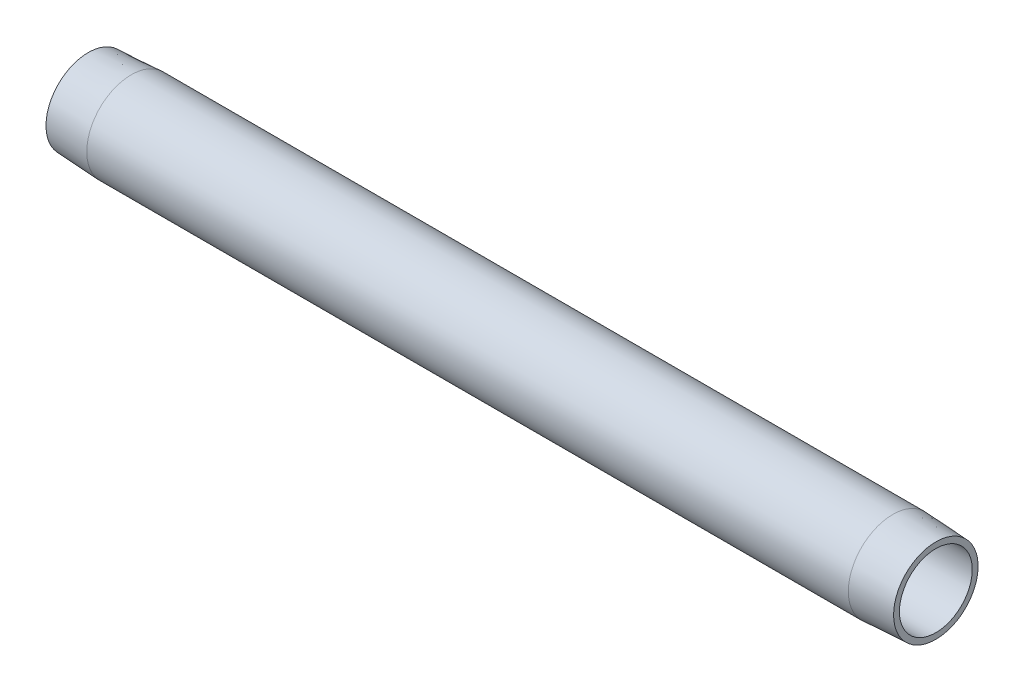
SolidWorks part; units mm, degrees
ref_plane "Front Plane" through (0, 0, 0) normal (0, 0, 1) x (1, 0, 0)
ref_plane "Top Plane" through (0, 0, 0) normal (0, 1, 0) x (1, 0, 0)
ref_plane "Right Plane" through (0, 0, 0) normal (1, 0, 0) x (0, 0, -1)
sketch "Sketch1" plane through (0, 0, 0) normal (0, 0, 1) x (1, 0, 0)
  line L6 (203.2, 8.7313) -> (0, 8.7313)
  line L7 (10.3124, 10.668) -> (0, 10.1276)
  line L8 (192.8876, 10.668) -> (10.3124, 10.668)
  line L9 (203.2, 10.1276) -> (192.8876, 10.668)
  line L10 (203.2, 8.7313) -> (203.2, 10.1276)
  line L11 (0, 10.1276) -> (0, 8.7313)
  line L12 (0, 0) -> (50000, 0) construction
  line L13 (0, -55) -> (0, 55) construction
  dimension "D1" = 203.2
  dimension "D2" = 3
  dimension "D3" = 3
  dimension "D4" = 21.336
  dimension "D5" = 17.4625
  dimension "D6" = 10.3124
  dimension "D7" = 10.3124
revolve "Revolve1" add sketch "Sketch1" angle 360 about L12
